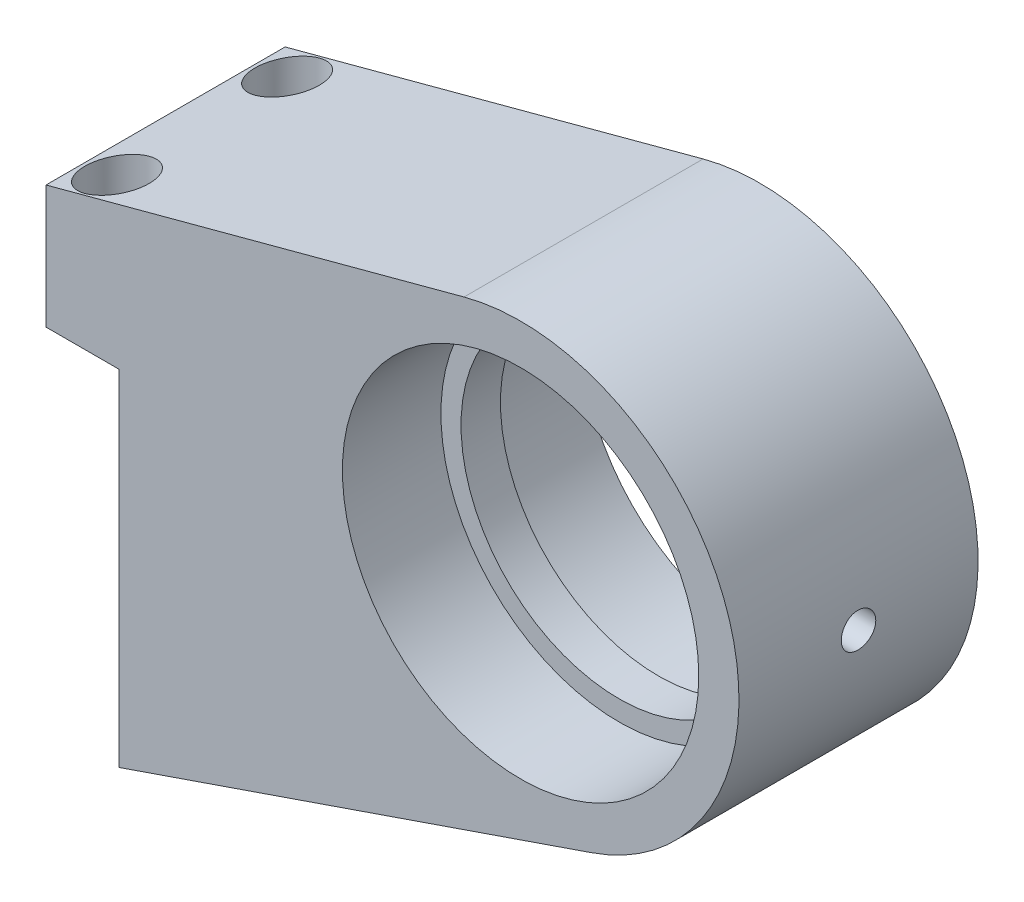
SolidWorks part; units mm, degrees
ref_plane "Front Plane" through (0, 0, 0) normal (0, 0, 1) x (1, 0, 0)
ref_plane "Top Plane" through (0, 0, 0) normal (0, 1, 0) x (1, 0, 0)
ref_plane "Right Plane" through (0, 0, 0) normal (1, 0, 0) x (0, 0, -1)
imported_body "Imported3"
sketch "Sketch1" plane through (-210.6197, 0, 0) normal (-1, 0, 0) x (0, 0, 1)
  line L0 (26.5, 45.9068) -> (26.5, 105.9068)
  line L1 (26.5, 105.9068) -> (0, 105.9068)
  line L2 (0, 105.9068) -> (0, 70.7439)
  arc A0 (0, 70.7439) -> (21.3486, 52.1858) centre (-2.85, 45.9068) cw
  arc A1 (21.3486, 52.1858) -> (24.5081, 48.7324) centre (26.1884, 53.4416) ccw
  arc A2 (24.5081, 48.7324) -> (26.5, 45.9068) centre (23.5, 45.9068) cw
extrude "Cut-Extrude1" cut sketch "Sketch1" against normal blind 12.7
sketch "Sketch2" plane through (0, 0, 26.5) normal (0, 0, 1) x (1, 0, 0)
  line L0 (-115.6968, 74.1724) -> (-197.9197, 45.9068)
  line L1 (-197.9197, 45.9068) -> (-197.9197, 105.9068)
  line L2 (-197.9197, 105.9068) -> (-210.6197, 105.9068)
  line L3 (-210.6197, 105.9068) -> (-210.6197, 127.3244)
  line L4 (-210.6197, 127.3244) -> (-137.8855, 146.8135)
  arc A0 (-137.8855, 146.8135) -> (-115.6968, 74.1724) centre (-128.0504, 110.1083) cw
extrude "Boss-Extrude1" add sketch "Sketch2" along normal blind 15.1
ref_plane "Plane1" through (0, 110.1083, 0) normal (0, 1, 0) x (1, 0, 0)
sketch "Sketch3" plane through (0, 110.1083, 0) normal (0, 1, 0) x (1, 0, 0)
  line L0 (-97.0504, 0) -> (-128.0504, 0)
  line L1 (-128.0504, 0) -> (-128.0504, -41.6)
  line L2 (-128.0504, -41.6) -> (-97.0504, -41.6)
  line L3 (-97.0504, -41.6) -> (-97.0504, -24.46)
  line L4 (-97.0504, -24.46) -> (-100.5504, -24.46)
  line L5 (-100.5504, -24.46) -> (-100.5504, -17.6)
  line L6 (-100.5504, -17.6) -> (-97.0504, -17.6)
  line L7 (-97.0504, -17.6) -> (-97.0504, 0)
  line L8 (-128.0504, 0) -> (-128.0504, -41.6) construction
revolve "Cut-Revolve1" cut sketch "Sketch3" angle 360 about L8
hole_wizard "#10 Clearance Hole1" positions "Sketch5" profile "Sketch4" hole size "#10" standard "ANSI Inch"
sketch "Sketch5" plane through (-197.9197, 0, 0) normal (-1, 0, 0) x (0, 0, 1)
  point P0 (20.8, 67.9068)
  point P1 (35.6, 51.9068)
  point P2 (35.6, 75.9068)
  point P3 (6, 75.9068)
  point P4 (20.8, 83.9068)
  point P5 (20.8, 99.9068)
sketch "Sketch4" plane through (-197.9197, 67.9068, 20.8) normal (0, 1, 0) x (0, 0, 1)
  line L0 (0, 0) -> (0, 10)
  line L1 (0, 10) -> (2.5, 10)
  line L2 (2.5, 10) -> (2.5, 0)
  line L5 (2.5, 0) -> (0, 0)
  line L10 (0, 10) -> (-2.5, 10) construction
  line L11 (0, -6.35) -> (0, 107.95) construction
  dimension "Hole Dia." = 5
  dimension "Hole Depth" = 10
  dimension "Drill Angle" = 180
ref_plane "Plane2" through (0, 130.5264, 0) normal (0, 1, 0) x (1, 0, 0)
hole_wizard "CBORE for 1/4 Binding Head Machine Screw1" positions "Sketch7" profile "Sketch6" counterbore size "1/4" standard "ANSI Inch"
sketch "Sketch7" plane through (0, 130.5264, 0) normal (0, 1, 0) x (1, 0, 0)
  point P0 (-204.2697, -6)
  point P1 (-204.2697, -35.6)
sketch "Sketch6" plane through (-204.2697, 130.5264, 6) normal (1, 0, 0) x (0, 0, 1)
  line L0 (0, 0) -> (0, 84.6196)
  line L1 (0, 84.6196) -> (3.3, 84.6196)
  line L3 (3.3, 84.6196) -> (3.3, 14.6195)
  line L4 (3.3, 14.6195) -> (5.6, 14.6195)
  line L5 (5.6, 14.6195) -> (5.6, 0)
  line L7 (5.6, 0) -> (0, 0)
  line L11 (0, -6.35) -> (0, 107.95) construction
  dimension "Thru Hole Dia." = 6.6
  dimension "Thru Hole Depth" = 84.6196
  dimension "C'Bore Dia." = 11.2
  dimension "C'Bore Depth" = 14.6195
hole_wizard "#2 Clearance Hole1" positions "Sketch9" profile "Sketch8" hole size "#2" standard "ANSI Inch"
sketch "Sketch9" plane through (0, 0, 0) normal (0, 0, -1) x (-1, 0, 0)
  point P0 (190.4103, 84.4801)
  point P1 (180.2103, 106.7301)
sketch "Sketch8" plane through (-190.4103, 84.4801, 0) normal (1, 0, 0) x (0, 1, 0)
  line L0 (0, 0) -> (0, 4)
  line L1 (0, 4) -> (1.25, 4)
  line L2 (1.25, 4) -> (1.25, 0)
  line L5 (1.25, 0) -> (0, 0)
  line L10 (0, 4) -> (-1.25, 4) construction
  line L11 (0, -6.35) -> (0, 107.95) construction
  dimension "Hole Dia." = 2.5
  dimension "Hole Depth" = 4
  dimension "Drill Angle" = 180
ref_plane "Plane3" through (-90.0504, 0, 0) normal (1, 0, 0) x (0, 0, -1)
hole_wizard "#12 Clearance Hole1" positions "Sketch11" profile "Sketch10" hole size "#12" standard "ANSI Inch"
sketch "Sketch11" plane through (-90.0504, 0, 0) normal (1, 0, 0) x (0, 0, -1)
  point P0 (-20.8, 110.0741)
sketch "Sketch10" plane through (-90.0504, 110.0741, 20.8) normal (0, 1, 0) x (0, 0, -1)
  line L0 (0, 0) -> (0, 10.5)
  line L1 (0, 10.5) -> (3, 10.5)
  line L2 (3, 10.5) -> (3, 0)
  line L5 (3, 0) -> (0, 0)
  line L11 (0, -6.35) -> (0, 107.95) construction
  dimension "Thru Hole Dia." = 6
  dimension "Thru Hole Depth" = 10.5
